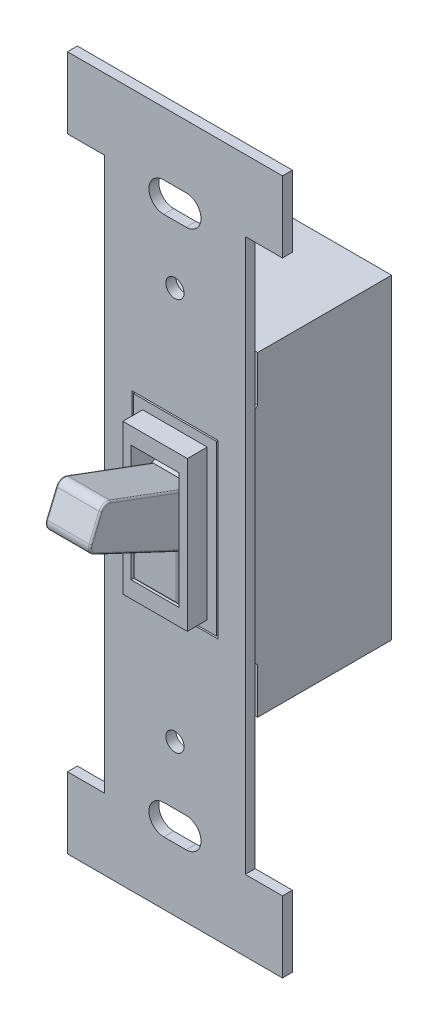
SolidWorks part; units mm, degrees
ref_plane "Front Plane" through (0, 0, 0) normal (0, 0, 1) x (1, 0, 0)
ref_plane "Top Plane" through (0, 0, 0) normal (0, 1, 0) x (1, 0, 0)
ref_plane "Right Plane" through (0, 0, 0) normal (1, 0, 0) x (0, 0, -1)
sketch "Sketch1" plane through (0, 0, 0) normal (0, 0, 1) x (1, 0, 0)
  line L0 (-10.795, 42.418) -> (-16.51, 42.418)
  line L1 (-16.51, 53.34) -> (16.51, 53.34)
  line L2 (-16.51, 53.34) -> (-16.51, 42.418)
  line L3 (-16.51, -53.34) -> (16.51, -53.34)
  line L4 (16.51, 53.34) -> (16.51, 42.418)
  line L6 (-10.795, 42.418) -> (-10.795, -42.418)
  line L8 (10.795, 42.418) -> (10.795, -42.418)
  line L9 (10.795, 42.418) -> (16.51, 42.418)
  line L10 (-10.795, -42.418) -> (-16.51, -42.418)
  line L11 (10.795, -42.418) -> (16.51, -42.418)
  line L12 (-16.51, -42.418) -> (-16.51, -53.34)
  line L13 (16.51, -42.418) -> (16.51, -53.34)
  line L14 (-1.7145, 41.402) -> (1.7145, 41.402) construction
  line L15 (-1.7145, 43.688) -> (1.7145, 43.688)
  line L16 (-1.7145, 39.116) -> (1.7145, 39.116)
  line L17 (55, 0) -> (-55, 0) construction
  line L18 (-1.7145, -41.402) -> (1.7145, -41.402) construction
  line L19 (-1.7145, -43.688) -> (1.7145, -43.688)
  line L20 (-1.7145, -39.116) -> (1.7145, -39.116)
  line L22 (-6.604, 13.208) -> (6.604, 13.208)
  line L23 (-6.604, 13.208) -> (-6.604, -13.208)
  line L24 (-6.604, -13.208) -> (6.604, -13.208)
  line L25 (6.604, 13.208) -> (6.604, -13.208)
  arc A0 (-1.7145, 43.688) -> (-1.7145, 39.116) centre (-1.7145, 41.402) ccw
  arc A1 (1.7145, 39.116) -> (1.7145, 43.688) centre (1.7145, 41.402) ccw
  arc A2 (-1.7145, -43.688) -> (-1.7145, -39.116) centre (-1.7145, -41.402) cw
  arc A3 (1.7145, -39.116) -> (1.7145, -43.688) centre (1.7145, -41.402) cw
  point P4 (0, 53.34)
  point P6 (0, 41.402)
  point P12 (-10.795, 0)
  point P20 (0, 13.208)
  point P21 (-6.604, 0)
  point P28 (0, -41.402)
  dimension "D4" = 41.402
  dimension "D9" = 3.429
  dimension "D1" = 106.68
  dimension "D2" = 33.02
  dimension "D3" = 21.59
  dimension "D5" = 10.922
  dimension "D6" = 10.922
  dimension "D7" = 10.922
  dimension "D8" = 4.572
  dimension "D10" = 13.208
  dimension "D11" = 26.416
extrude "Boss-Extrude1" add sketch "Sketch1" along normal blind 1.524
ref_plane "Plane1" through (0, 0, -2.159) normal (0, 0, 1) x (1, 0, 0)
sketch "Sketch2" plane through (0, 0, -2.159) normal (0, 0, 1) x (1, 0, 0)
  line L1 (-9.017, 24.257) -> (9.017, 24.257)
  line L2 (-9.017, 24.257) -> (-9.017, -24.257)
  line L3 (-9.017, -24.257) -> (9.017, -24.257)
  line L4 (9.017, 24.257) -> (9.017, -24.257)
  point P4 (0, 24.257)
  point P6 (-9.017, 0)
  dimension "D1" = 48.514
  dimension "D2" = 18.034
extrude "Boss-Extrude2" add sketch "Sketch2" against normal blind 20.574 separate body
sketch "Sketch3" plane through (0, 0, -2.159) normal (0, 0, 1) x (1, 0, 0)
  line L0 (-9.017, 24.257) -> (-9.017, -24.257) construction
  line L1 (-9.017, 17.272) -> (9.017, 17.272)
  line L2 (-9.017, 17.272) -> (-9.017, -17.272)
  line L3 (-9.017, -17.272) -> (9.017, -17.272)
  line L4 (9.017, 17.272) -> (9.017, -17.272)
  line L5 (9.017, -24.257) -> (9.017, 24.257) construction
  point P8 (-9.017, 0)
  point P10 (0, 17.272)
  dimension "D1" = 34.544
extrude "Boss-Extrude3" add sketch "Sketch3" along normal up to surface (2.159 mm away)
chamfer "Chamfer1" distance 2.159 angle 45 2 edges at (0, -17.272, 0) (0, 17.272, 0)
sketch "Sketch4" plane through (0, 0, 0) normal (0, 0, 1) x (1, 0, 0)
  line L1 (-6.35, 12.954) -> (6.35, 12.954)
  line L2 (-6.35, 12.954) -> (-6.35, -12.954)
  line L3 (-6.35, -12.954) -> (6.35, -12.954)
  line L4 (6.35, 12.954) -> (6.35, -12.954)
  point P4 (0, 12.954)
  point P6 (-6.35, 0)
  dimension "D1" = 12.7
  dimension "D2" = 25.908
extrude "Boss-Extrude4" add sketch "Sketch4" along normal blind 1.524
sketch "Sketch5" plane through (0, 0, 1.524) normal (0, 0, 1) x (1, 0, 0)
  line L1 (-4.953, 11.4935) -> (4.953, 11.4935)
  line L2 (-4.953, 11.4935) -> (-4.953, -11.4935)
  line L3 (-4.953, -11.4935) -> (4.953, -11.4935)
  line L4 (4.953, 11.4935) -> (4.953, -11.4935)
  point P4 (0, 11.4935)
  point P6 (-4.953, 0)
  dimension "D1" = 22.987
  dimension "D2" = 9.906
extrude "Boss-Extrude5" add sketch "Sketch5" along normal blind 3.048
sketch "Sketch6" plane through (0, 0, 4.572) normal (0, 0, 1) x (1, 0, 0)
  line L1 (-3.683, 8.9535) -> (3.683, 8.9535)
  line L2 (-3.683, 8.9535) -> (-3.683, -8.9535)
  line L3 (-3.683, -8.9535) -> (3.683, -8.9535)
  line L4 (3.683, 8.9535) -> (3.683, -8.9535)
  point P4 (0, 8.9535)
  point P6 (-3.683, 0)
  dimension "D1" = 7.366
  dimension "D2" = 17.907
extrude "Cut-Extrude1" cut sketch "Sketch6" against normal up to surface (4.572 mm away)
ref_plane "Plane2" through (3.429, 0, 0) normal (-1, 0, 0) x (0, 0, 1)
sketch "Sketch7" plane through (3.429, 0, 0) normal (-1, 0, 0) x (0, 0, 1)
  line L0 (4.572, -1.7145) -> (18.3653, 4.7664)
  line L2 (0, 6.2108) -> (0, -8.6995)
  line L3 (0, -8.6995) -> (4.572, -8.6995)
  line L4 (4.572, -1.7145) -> (4.572, -8.6995)
  line L5 (18.3653, 4.7664) -> (15.9068, 10.6211)
  line L6 (15.9068, 10.6211) -> (1.6217, 5.3112)
  line L7 (1.6217, 5.3112) -> (0, 6.2108)
  point P6 (4.572, -1.7145)
  point P19 (0, 6.2108)
  dimension "D2" = 4.572
  dimension "D3" = 6.985
  dimension "D4" = 6.35
  dimension "D5" = 7.62
  dimension "D7" = 15.24
extrude "Boss-Extrude6" add sketch "Sketch7" along normal blind 6.858
fillet "Fillet1" radius 1.27 2 edges at (0, 10.6211, 15.9068) (0, 4.7664, 18.3653)
fillet "Fillet2" radius 0.254 13 edges at (3.429, 7.7539, 8.1934) (3.429, 10.1717, 15.7122) (3.429, 7.6937, 17.1361) (3.429, 4.9421, 17.9082) (-3.429, 7.7539, 8.1934) (-3.429, 10.1717, 15.7122) (-3.429, 7.6937, 17.1361) (-3.429, 4.9421, 17.9082) (0, -8.6995, 4.572) (-3.429, -5.207, 4.572) (3.429, -5.207, 4.572) (3.429, 1.2669, 10.9174) (-3.429, 1.2669, 10.9174)
sketch "Sketch8" plane through (0, 0, 1.524) normal (0, 0, 1) x (1, 0, 0)
  circle A0 centre (0, 30.1625) radius 1.397
  circle A1 centre (0, -30.1625) radius 1.397
  point P0 (0, 30.1625)
  point P1 (0, -30.1625)
  dimension "D1" = 60.325
  dimension "D2" = 30.1625
extrude "Cut-Extrude2" cut sketch "Sketch8" against normal up to next
